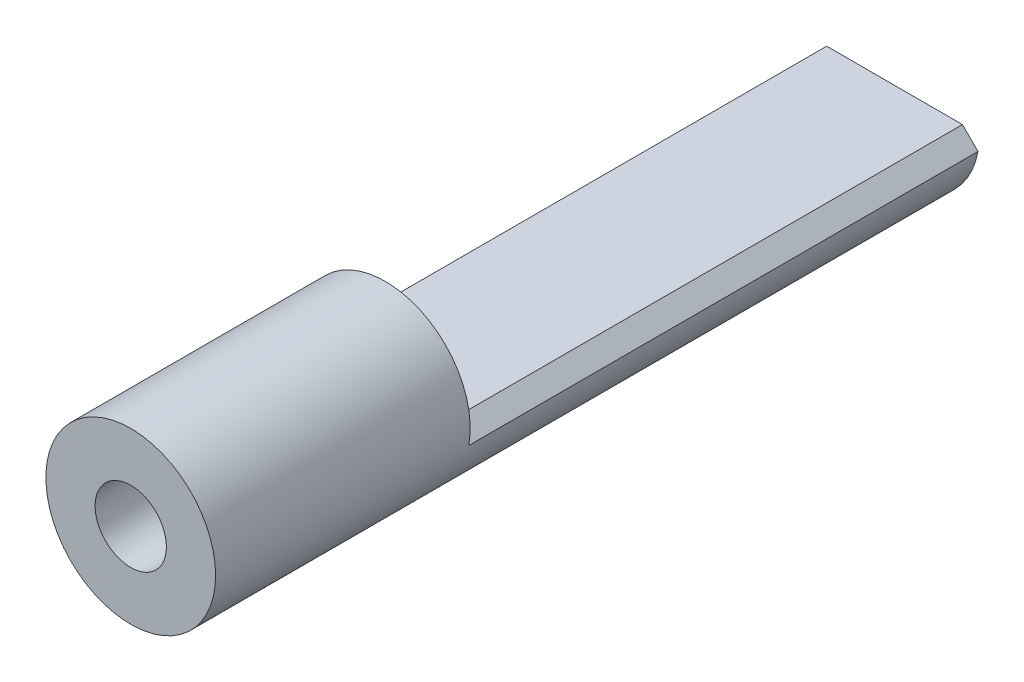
SolidWorks part; units mm, degrees
ref_plane "Plano frontal" through (0, 0, 0) normal (0, 0, 1) x (1, 0, 0)
ref_plane "Plano superior" through (0, 0, 0) normal (0, 1, 0) x (1, 0, 0)
ref_plane "Plano direito" through (0, 0, 0) normal (1, 0, 0) x (0, 0, -1)
sketch "Esboço1" plane through (0, 0, 0) normal (0, 0, 1) x (1, 0, 0)
  circle A0 centre (0, 0) radius 5
  dimension "D1" = 10
extrude "Ressalto-extrusão1" add sketch "Esboço1" along normal blind 45
sketch "Esboço10" plane through (0, 0, 0) normal (0, 0, -1) x (-1, 0, 0)
  line L0 (-5, 0) -> (5, 0)
  arc A0 (5, 0) -> (-5, 0) centre (0, 0) ccw
  dimension "D1" = 10
extrude "Corte-extrusão2" cut sketch "Esboço10" against normal offset from surface (30 mm away) 15
hole_wizard "Furo roscado de M51" positions "3DSketch6" profile "Esboço11" tap size "M5" standard "ISO"
sketch3d "3DSketch6"
  line L0 (0, 0, 45) -> (0, 0, 30) construction
  point P0 (0, 0, 45)
sketch "Esboço11" plane through (0, 0, 45) normal (1, 0, 0) x (0, -1, 0)
  line L0 (0, 0) -> (0, 14)
  line L1 (0, 14) -> (2.1, 12.7382)
  line L2 (2.1, 12.7382) -> (2.1, 0)
  line L5 (2.1, 0) -> (0, 0)
  line L10 (0, 14) -> (-2.1, 12.7382) construction
  line L11 (0, -6.35) -> (0, 107.95) construction
  dimension "Tap Drill Dia." = 4.2
  dimension "Tap Drill Depth" = 14
  dimension "Drill Angle" = 118
sketch "Esboço12" plane through (0, 0, 45) normal (0, 0, 1) x (1, 0, 0)
  point P0 (0, 0)
chamfer "Chanfro1" distance 1 2 edges at (-5, 0, 15) (5, 0, 15)
sketch "Esboço13" plane through (0, 0, 0) normal (0, 0, -1) x (-1, 0, 0)
  line L0 (-4, 0) -> (4, 0) construction
  line L2 (2.4749, -2.4749) -> (0, 0) construction
  line L3 (0, 0) -> (-2.4749, -2.4749) construction
  arc A0 (3.5, 0) -> (-3.5, 0) centre (0, 0) cw construction
  dimension "D1" = 3.5
  dimension "D2" = 45
hole_wizard "Furo roscado de M21" positions "3DSketch7" profile "Esboço14" tap size "M2" standard "ISO"
sketch3d "3DSketch7"
  point P0 (2.4749, -2.4749, 0)
  point P3 (-2.4749, -2.4749, 0)
sketch "Esboço14" plane through (2.4749, -2.4749, 0) normal (1, 0, 0) x (0, 1, 0)
  line L0 (0, 0) -> (0, 6.4807)
  line L1 (0, 6.4807) -> (0.8, 6)
  line L2 (0.8, 6) -> (0.8, 0)
  line L5 (0.8, 0) -> (0, 0)
  line L10 (0, 6.4807) -> (-0.8, 6) construction
  line L11 (0, -6.35) -> (0, 107.95) construction
  dimension "Tap Drill Dia." = 1.6
  dimension "Tap Drill Depth" = 6
  dimension "Drill Angle" = 118
